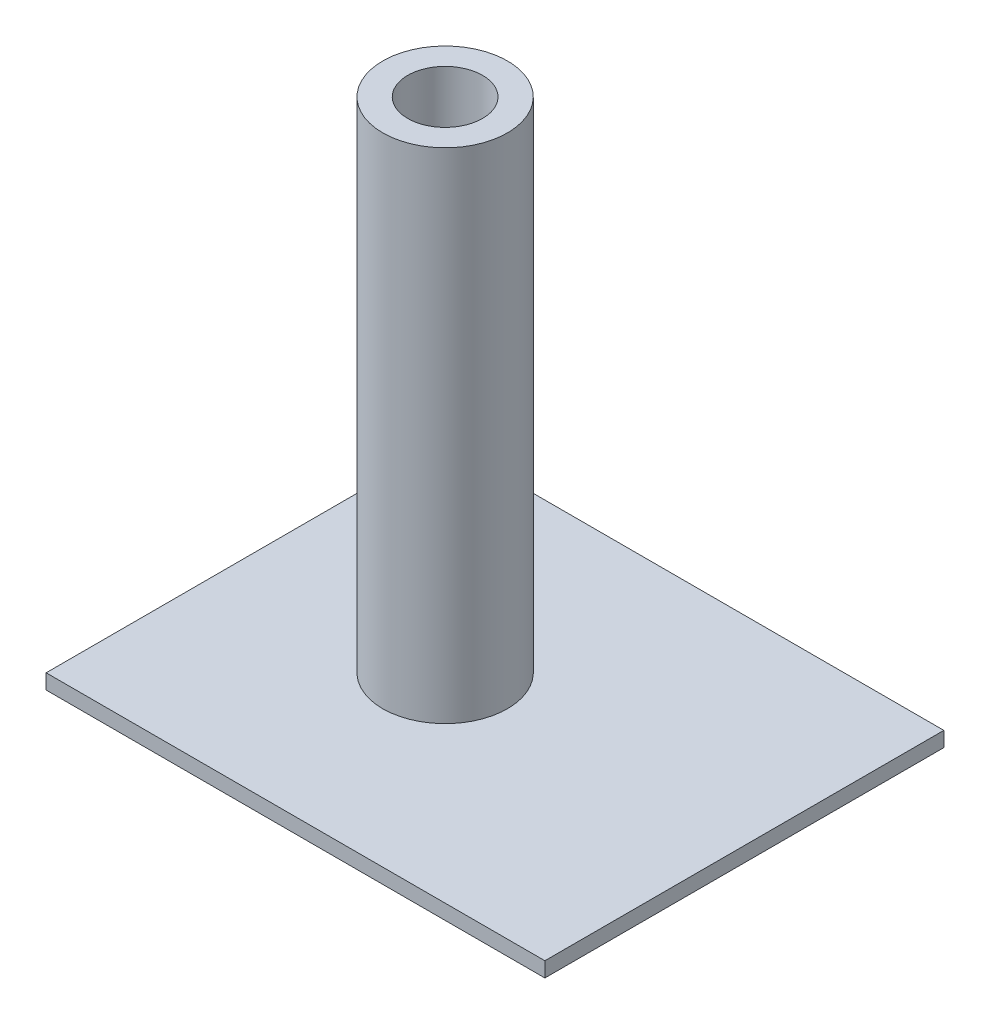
SolidWorks part; units mm, degrees
ref_plane "Front Plane" through (0, 0, 0) normal (0, 0, 1) x (1, 0, 0)
ref_plane "Top Plane" through (0, 0, 0) normal (0, 1, 0) x (1, 0, 0)
ref_plane "Right Plane" through (0, 0, 0) normal (1, 0, 0) x (0, 0, -1)
sketch "Sketch1" plane through (0, 0, 0) normal (0, 1, 0) x (1, 0, 0)
  line L0 (0, 0) -> (-10, 0) construction
  line L1 (-50, 40) -> (50, 40)
  line L2 (-50, 40) -> (-50, -40)
  line L3 (-50, -40) -> (50, -40)
  line L4 (50, 40) -> (50, -40)
  line L5 (-50, 40) -> (50, -40) construction
  line L6 (-50, -40) -> (50, 40) construction
  point P0 (0, 0)
sketch "Sketch2" plane through (0, 0, 0) normal (0, 1, 0) x (1, 0, 0)
  circle A0 centre (-10, 0) radius 12.5
extrude "Boss-Extrude1" add sketch "Sketch1" against normal blind 3 contours L3 L4 L1 L2
extrude "Extrude-Thin1" add sketch "Sketch2" along normal blind 100 thin
